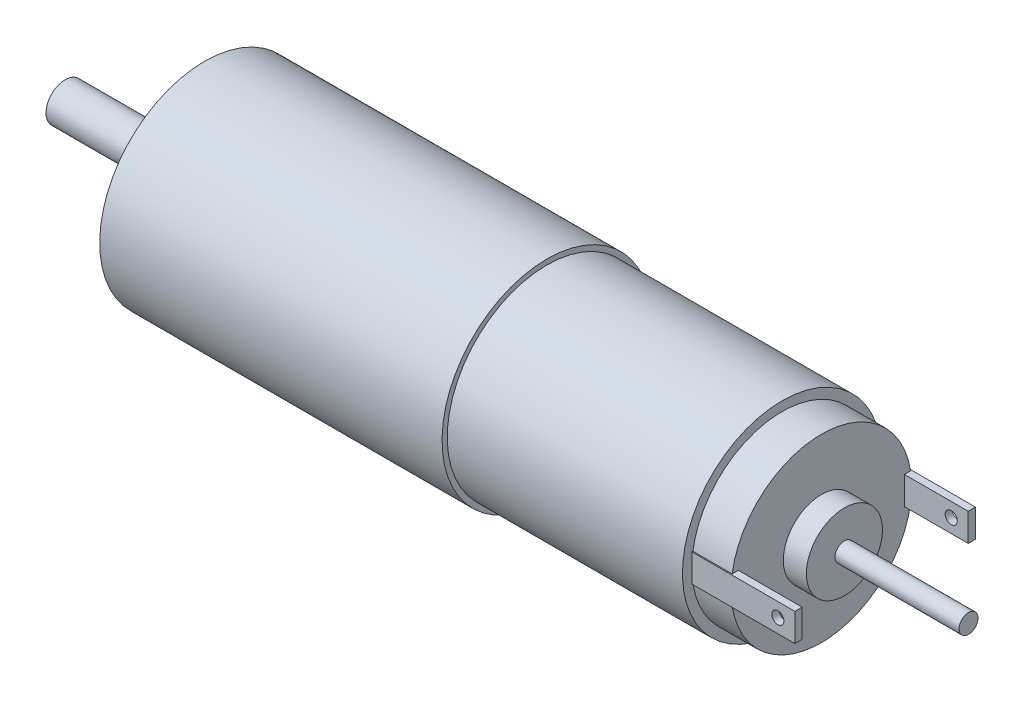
SolidWorks part; units mm, degrees
ref_plane "Front Plane" through (0, 0, 0) normal (0, 0, 1) x (1, 0, 0)
ref_plane "Top Plane" through (0, 0, 0) normal (0, 1, 0) x (1, 0, 0)
ref_plane "Right Plane" through (0, 0, 0) normal (1, 0, 0) x (0, 0, -1)
sketch "Sketch1" plane through (0, 0, 0) normal (0, 0, 1) x (1, 0, 0)
  line L0 (44.1706, 0) -> (-50.4698, 0) construction
  line L1 (0, -10.4394) -> (24.638, -10.4394)
  line L2 (0, -10.4394) -> (0, -10.9855)
  line L3 (0, -10.9855) -> (-35.8648, -10.9855)
  line L4 (24.638, -10.4394) -> (24.638, -9.4615)
  line L5 (-35.8648, -10.9855) -> (-35.8648, -5.0038)
  line L6 (-35.8648, -5.0038) -> (-37.084, -5.0038)
  line L7 (-37.084, -5.0038) -> (-37.084, -3.4925)
  line L8 (-37.084, -3.4925) -> (-38.9636, -3.4925)
  line L9 (-38.9636, -3.4925) -> (-38.9636, -2.0066)
  line L10 (-38.9636, -2.0066) -> (-50.4698, -2.0066)
  line L11 (-50.4698, -2.0066) -> (-50.4698, 0)
  line L12 (28.7528, -3.9878) -> (31.1658, -3.9878)
  line L13 (24.638, -9.4615) -> (28.7528, -9.4615)
  line L14 (28.7528, -9.4615) -> (28.7528, -3.9878)
  line L15 (31.1658, -3.9878) -> (31.1658, -0.9906)
  line L16 (31.1658, -0.9906) -> (44.1706, -0.9906)
  line L17 (44.1706, -0.9906) -> (44.1706, 0)
  line L18 (-50.4698, 0) -> (44.1706, 0)
  dimension "D1" = 21.971
  dimension "D2" = 24.638
  dimension "D3" = 20.8788
  dimension "D4" = 35.8648
  dimension "D5" = 10.0076
  dimension "D6" = 1.2192
  dimension "D7" = 6.985
  dimension "D8" = 1.8796
  dimension "D9" = 4.0132
  dimension "D10" = 11.5062
  dimension "D11" = 18.923
  dimension "D12" = 4.1148
  dimension "D13" = 7.9756
  dimension "D14" = 2.413
  dimension "D15" = 1.9812
  dimension "D16" = 13.0048
revolve "Revolve1" add sketch "Sketch1" angle 360 about L0
sketch "Sketch2" plane through (24.638, 0, 0) normal (1, 0, 0) x (0, 0, -1)
  line L1 (8.6995, 1.4605) -> (9.4615, 1.4605)
  line L2 (8.6995, 1.4605) -> (8.6995, -1.4605)
  line L3 (8.6995, -1.4605) -> (9.4615, -1.4605)
  line L4 (9.4615, 1.4605) -> (9.4615, -1.4605)
  circle A0 centre (0, 0) radius 9.4615 construction
  point P4 (9.4615, 0)
  dimension "D1" = 2.921
  dimension "D2" = 0.762
extrude "Extrude1" add sketch "Sketch2" along normal blind 10.795
mirror "Mirror1" about plane through (0, 0, 0) normal (0, 0, 1) of "Extrude1"
sketch "Sketch3" plane through (0, 0, -9.4615) normal (0, 0, -1) x (-1, 0, 0)
  line L0 (-35.433, -1.4605) -> (-35.433, 1.4605) construction
  circle A0 centre (-33.655, 0) radius 0.635
  dimension "D1" = 1.27
  dimension "D2" = 1.778
extrude "Cut-Extrude1" cut sketch "Sketch3" against normal up to next
mirror "Mirror2" about plane through (0, 0, 0) normal (0, 0, 1) of "Cut-Extrude1"
hole_wizard "#3-48 Tapped Hole1" positions "3DSketch1" profile "Sketch5" tap size "#3-48" standard "Ansi Inch"
sketch3d "3DSketch1"
  line L2 (0, 0, 0) -> (-35.8648, -3.4975, 6.0579) construction
  line L4 (0, 0, 0) -> (-35.8648, -3.4975, -6.0579) construction
  line L5 (0, 0, 0) -> (-35.8648, 6.9951, 0) construction
  point P0 (-35.8648, 6.9951, 0)
  point P3 (-35.8648, -3.4975, 6.0579)
  point P5 (-35.8648, -3.4975, -6.0579)
  dimension "D1" = 12.1158
  dimension "D2" = 12.1158
  dimension "D3" = 12.1158
sketch "Sketch5" plane through (-35.8648, 6.9951, 0) normal (0, 1, 0) x (0, 0, 1)
  line L0 (0, 0) -> (0, 8.2698)
  line L1 (0, 8.2698) -> (0.9969, 7.6708)
  line L2 (0.9969, 7.6708) -> (0.9969, 0)
  line L5 (0.9969, 0) -> (0, 0)
  line L10 (0, 8.2698) -> (-0.997, 7.6708) construction
  line L11 (0, -6.35) -> (0, 107.95) construction
  dimension "Tap Drill Dia." = 1.9939
  dimension "Tap Drill Depth" = 7.6708
  dimension "Drill Angle" = 118
